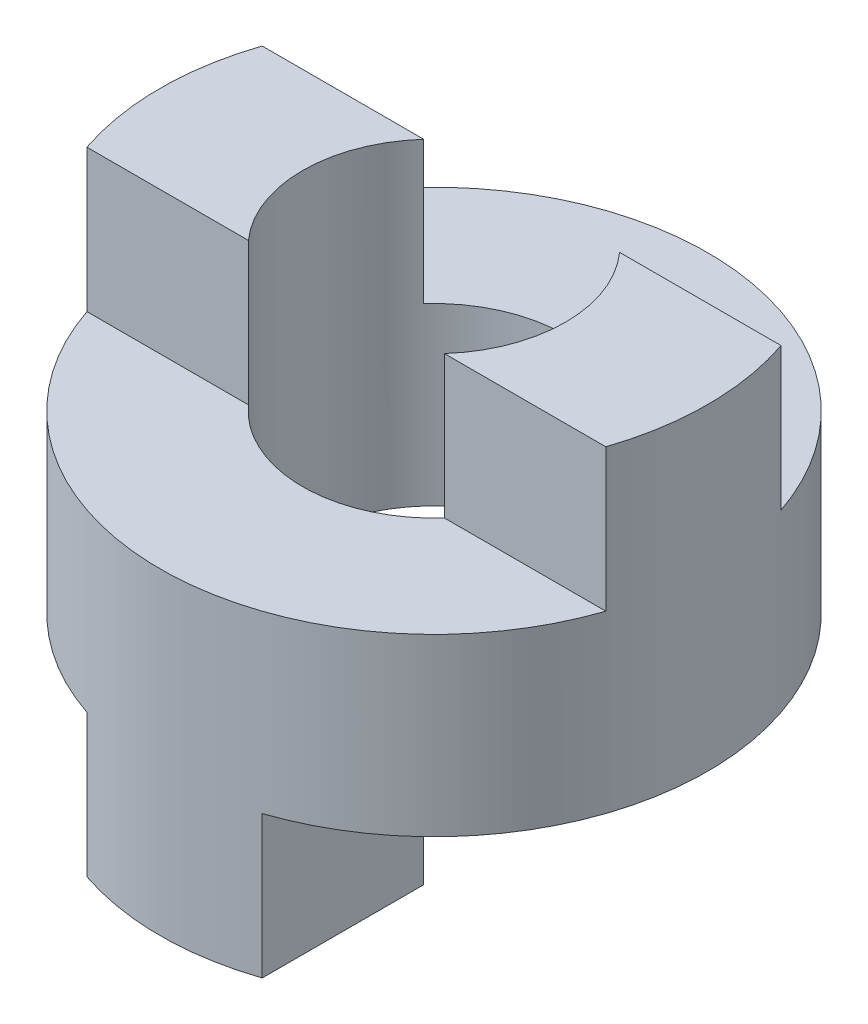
SolidWorks part; units mm, degrees
ref_plane "前视基准面" through (0, 0, 0) normal (0, 0, 1) x (1, 0, 0)
ref_plane "上视基准面" through (0, 0, 0) normal (0, 1, 0) x (1, 0, 0)
ref_plane "右视基准面" through (0, 0, 0) normal (1, 0, 0) x (0, 0, -1)
sketch "草图1" plane through (0, 0, 0) normal (0, 1, 0) x (1, 0, 0)
  circle A0 centre (0, 0) radius 12
  circle A1 centre (0, 0) radius 25
extrude "拉伸1" add sketch "草图1" along normal blind 42
sketch "草图2" plane through (0, 0, 0) normal (1, 0, 0) x (0, 0, -1)
  line L0 (0, 0) -> (0, 67.2052) construction
  line L1 (12, 42) -> (-12, 42) construction
  line L2 (-8, 42) -> (-8, 29)
  line L3 (-25, 42) -> (-8, 42)
  line L4 (-25, 29) -> (-25, 42)
  line L5 (-8, 29) -> (-25, 29)
  line L6 (8, 29) -> (25, 29)
  line L7 (25, 0) -> (25, 42) construction
  line L8 (25, 29) -> (25, 42)
  line L9 (25, 42) -> (8, 42)
  line L10 (25, 42) -> (-25, 42) construction
  line L11 (8, 42) -> (8, 29)
  dimension "D1" = 13
sketch "草图3" plane through (0, 0, 0) normal (0, 0, 1) x (1, 0, 0)
  line L0 (0, 0) -> (0, 56.2657) construction
  line L1 (-30.3109, 13) -> (-30.3109, -9.9474)
  line L2 (8, 13) -> (30.3109, 13)
  line L3 (8, 13) -> (8, -9.9474)
  line L4 (8, -9.9474) -> (30.3109, -9.9474)
  line L5 (30.3109, 13) -> (30.3109, -9.9474)
  line L6 (-8, -9.9474) -> (-30.3109, -9.9474)
  line L7 (-8, 13) -> (-8, -9.9474)
  line L8 (-8, 13) -> (-30.3109, 13)
  line L9 (-25, 0) -> (25, 0) construction
  dimension "D1" = 8
  dimension "D2" = 13
extrude "切除-拉伸2" cut sketch "草图3" against normal mid plane 80
extrude "切除-拉伸3" cut sketch "草图2" against normal mid plane 80
